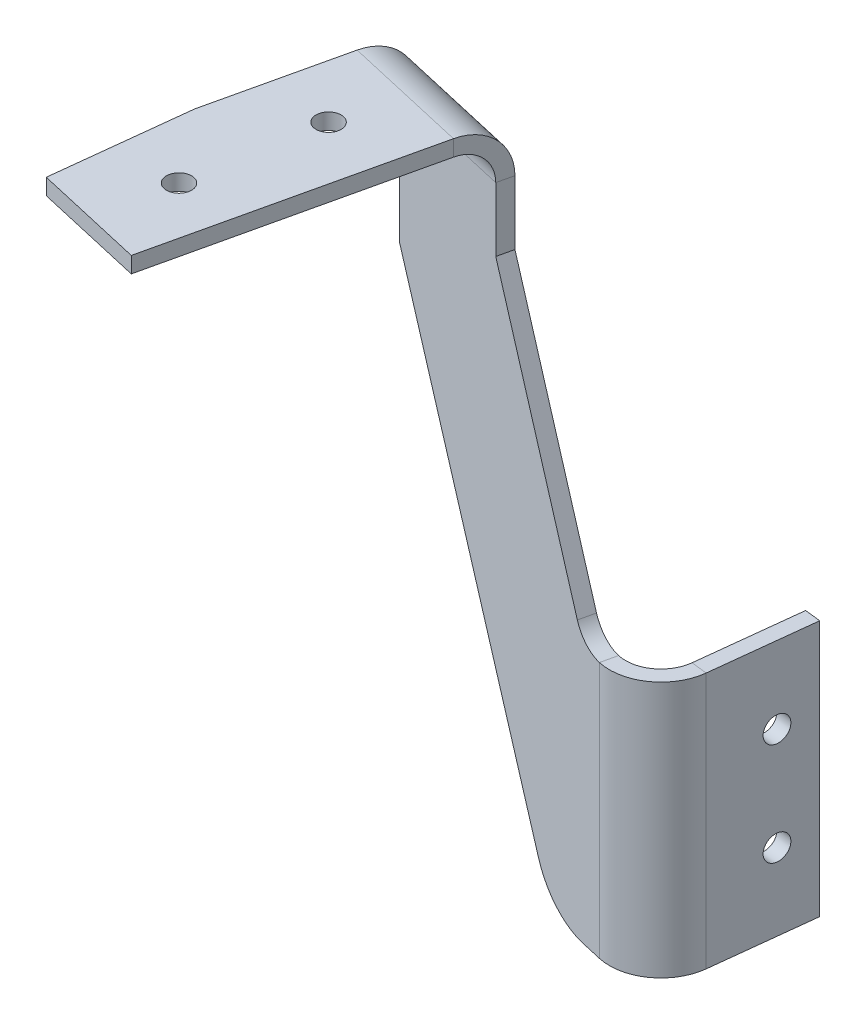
SolidWorks part; units mm, degrees
other "<Hex Frame Support>-<Fillet3>" parameters "Thickness"=3.175
ref_plane "Front Plane" through (0, 0, 0) normal (0, 0, 1) x (1, 0, 0)
ref_plane "Top Plane" through (0, 0, 0) normal (0, 1, 0) x (1, 0, 0)
ref_plane "Right Plane" through (0, 0, 0) normal (1, 0, 0) x (0, 0, -1)
mirrored part "Hex Frame Support_Mirrored"
bend "DerivedBend3" bend radius 7 bend angle 90 parameters "D5"=3
bend "DerivedBend4" bend radius 7 bend angle 96.44 parameters "D5"=4
sketch "Bend-Lines1" [suppressed] plane through (0, 0, 0) normal (0, 1, 0) x (1, 0, 0)
sketch "Bounding-Box1" [suppressed] plane through (0, 0, 0) normal (0, 1, 0) x (1, 0, 0)
sheet metal parameters "Sheet-Metal1" thickness 3.175 parameters "D1"=7
flat pattern "Flat-Pattern1"
sketch "Bend-Lines2" plane through (-0.5481, 0, 2.3968) normal (0.2229, 0, -0.9748) x (-0.9748, 0, -0.2229)
  line L4 (14.5547, -25.4) -> (14.5547, 25.4) construction
  line L5 (49.1124, 98.1696) -> (74.5124, 98.1696) construction
  line L6 (14.5547, -25.4) -> (14.5547, 25.4) construction
  line L7 (49.1124, 98.1696) -> (74.5124, 98.1696) construction
sketch3d "Bounding-Box2" [suppressed]
  line L0 (5.6638, -73.2226, 0) -> (85.5979, 109.3681, 0) construction
  line L1 (-51.4896, -48.2021, 0) -> (28.4446, 134.3886, 0) construction
  line L2 (5.6638, -73.2226, 0) -> (-51.4896, -48.2021, 0) construction
  line L3 (85.5979, 109.3681, 0) -> (28.4446, 134.3886, 0) construction
bend of the flat pattern "Flatten-<DerivedBend3>1"
bend of the flat pattern "Flatten-<DerivedBend4>1"
